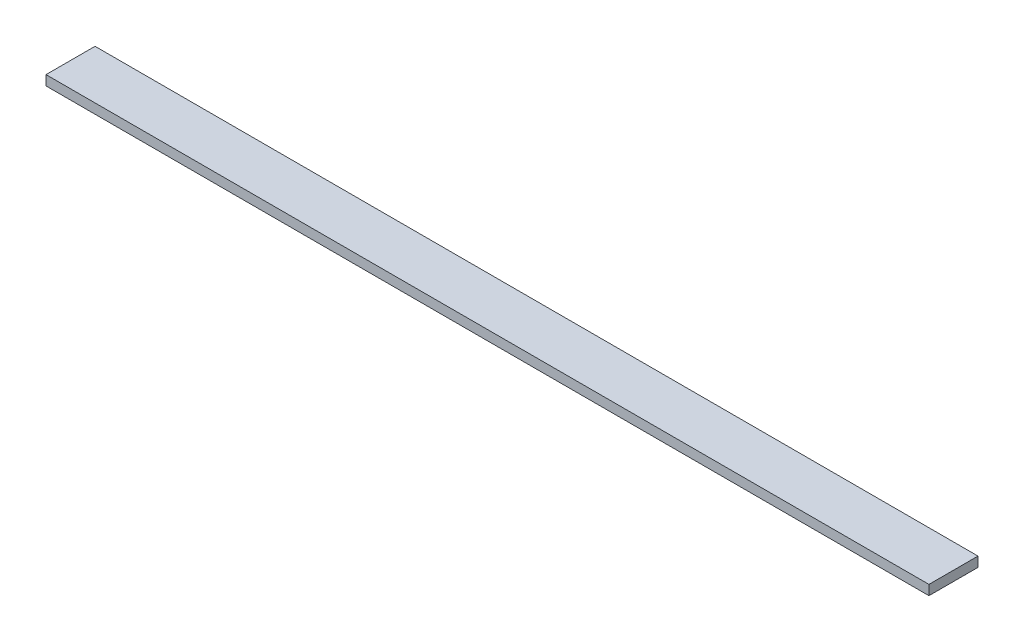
SolidWorks part; units mm, degrees
ref_plane "Piano frontale" through (0, 0, 0) normal (0, 0, 1) x (1, 0, 0)
ref_plane "Piano superiore" through (0, 0, 0) normal (0, 1, 0) x (1, 0, 0)
ref_plane "Piano destro" through (0, 0, 0) normal (1, 0, 0) x (0, 0, -1)
sketch "Schizzo1" plane through (0, 0, 0) normal (1, 0, 0) x (0, 0, -1)
  line L1 (-5, 1) -> (5, 1)
  line L2 (-5, 1) -> (-5, -1)
  line L3 (-5, -1) -> (5, -1)
  line L4 (5, 1) -> (5, -1)
  line L5 (-5, 1) -> (5, -1) construction
  line L6 (-5, -1) -> (5, 1) construction
  point P0 (0, 0)
  dimension "D1" = 2
  dimension "D2" = 10
extrude "Estrusione-Estrusione1" add sketch "Schizzo1" along normal blind 180
